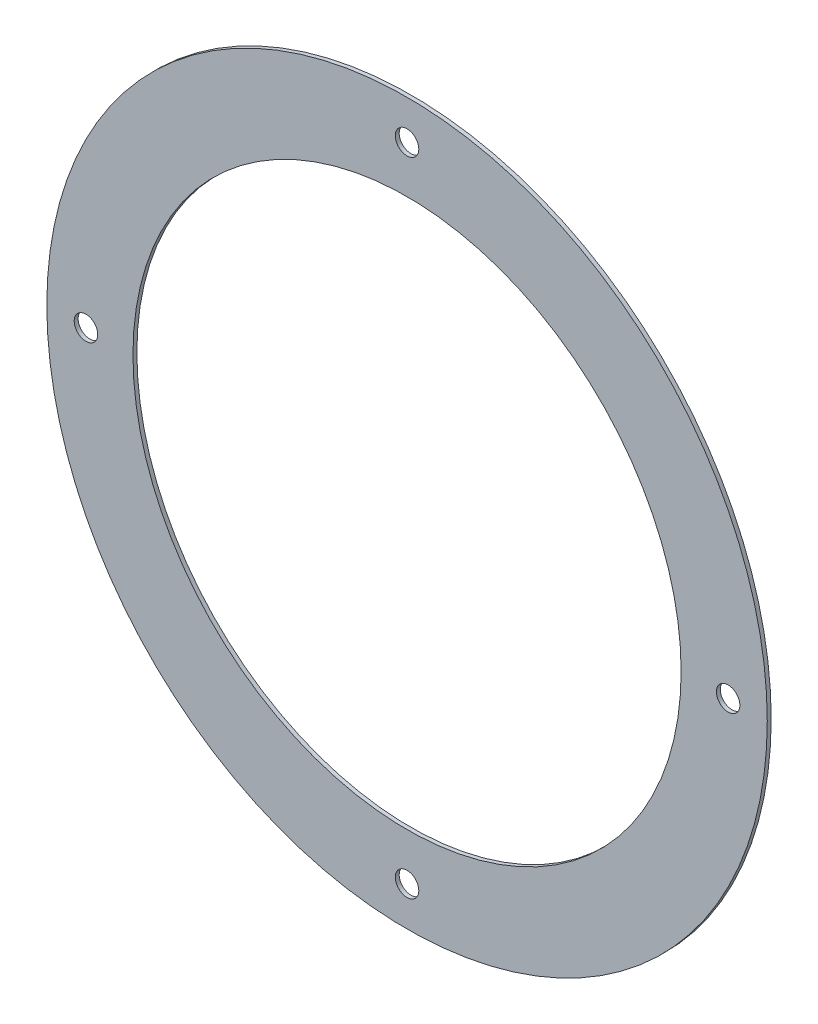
SolidWorks part; units mm, degrees
ref_plane "Face" through (0, 0, 0) normal (0, 0, 1) x (1, 0, 0)
ref_plane "Dessus" through (0, 0, 0) normal (0, 1, 0) x (1, 0, 0)
ref_plane "Droite" through (0, 0, 0) normal (1, 0, 0) x (0, 0, -1)
sketch "Esquisse1" plane through (0, 0, 0) normal (0, 0, 1) x (1, 0, 0)
  circle A0 centre (0, 0) radius 92
  circle A1 centre (0, 0) radius 70
  dimension "D1" = 184
  dimension "D2" = 140
extrude "Base-Extrusion" add sketch "Esquisse1" along normal blind 1
sketch "Esquisse3" plane through (0, 0, 1) normal (0, 0, 1) x (1, 0, 0)
  circle A0 centre (0, 82) radius 3
  circle A1 centre (-82, 0) radius 3
  circle A2 centre (82, 0) radius 3
  circle A3 centre (0, -82) radius 3
  dimension "D1" = 6
  dimension "D3" = 6
  dimension "D4" = 6
  dimension "D5" = 6
  dimension "D2" = 82
  dimension "D6" = 82
  dimension "D7" = 82
  dimension "D8" = 82
extrude "Enlèv. mat.-Extru.1" cut sketch "Esquisse3" against normal through all
